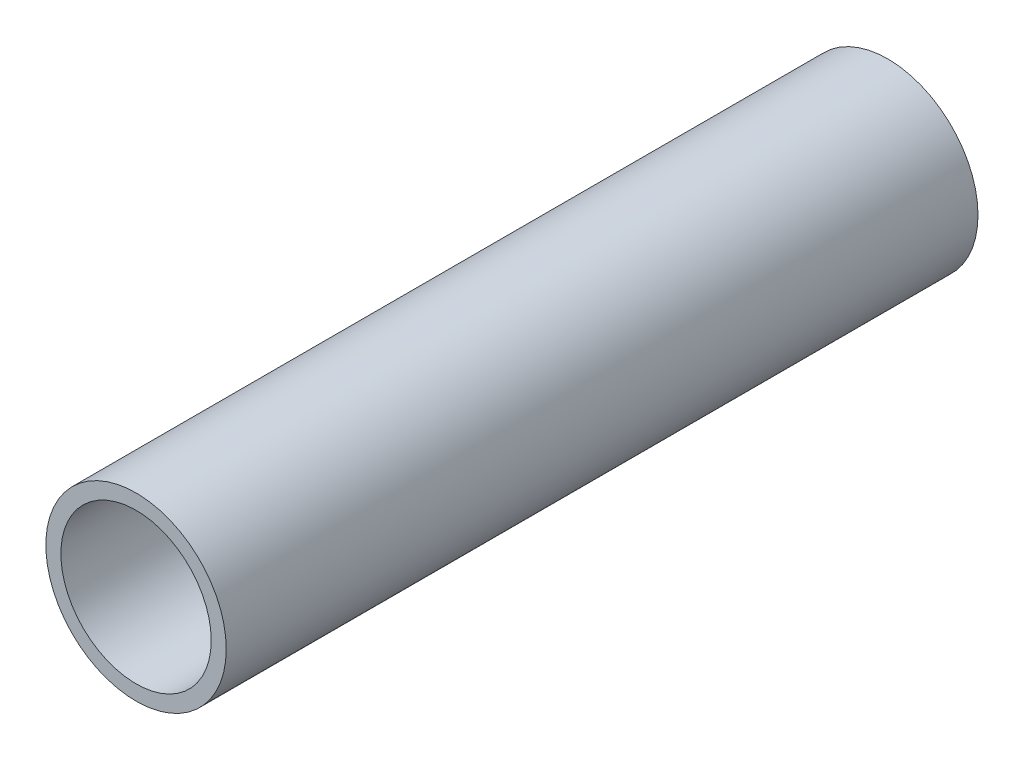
SolidWorks part; units mm, degrees
ref_plane "Plan de face" through (0, 0, 0) normal (0, 0, 1) x (1, 0, 0)
ref_plane "Plan de dessus" through (0, 0, 0) normal (0, 1, 0) x (1, 0, 0)
ref_plane "Plan de droite" through (0, 0, 0) normal (1, 0, 0) x (0, 0, -1)
sketch "Esquisse1" plane through (0, 0, 0) normal (0, 0, 1) x (1, 0, 0)
  circle A0 centre (0, 0) radius 6
  circle A1 centre (0, 0) radius 5
  dimension "D1" = 12
  dimension "D2" = 1
extrude "Extrusion1" add sketch "Esquisse1" along normal mid plane 50
